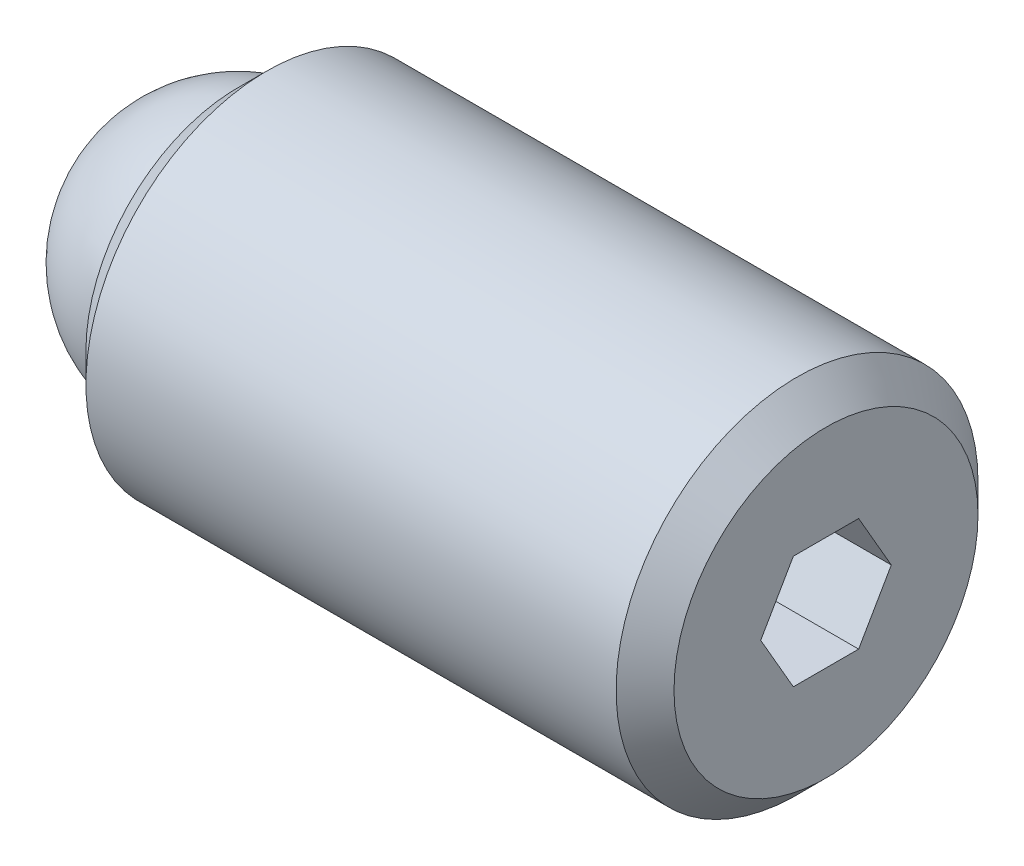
SolidWorks part; units mm, degrees
ref_plane "Front Plane" through (0, 0, 0) normal (0, 0, 1) x (1, 0, 0)
ref_plane "Top Plane" through (0, 0, 0) normal (0, 1, 0) x (1, 0, 0)
ref_plane "Right Plane" through (0, 0, 0) normal (1, 0, 0) x (0, 0, -1)
sketch "Sketch2" plane through (0, 0, 0) normal (1, 0, 0) x (0, 0, -1)
  circle A0 centre (0, 0) radius 3.175
  dimension "D1" = 6.35
extrude "Boss-Extrude1" add sketch "Sketch2" along normal blind 10.3187
sketch "Sketch3" plane through (0, 0, 0) normal (-1, 0, 0) x (0, 0, 1)
  circle A0 centre (0, 0) radius 2.3813
  dimension "D1" = 4.7625
chamfer "Chamfer1" distance 0.508 angle 45 1 edges at (0, 0, -3.175)
chamfer "Chamfer2" distance 0.508 angle 45 1 edges at (10.3187, 0, -3.175)
sketch "Sketch4" plane through (10.3187, 0, 0) normal (1, 0, 0) x (0, 0, -1)
  line L1 (1.1457, 0) -> (0.5728, 0.9922)
  line L2 (0.5728, 0.9922) -> (-0.5728, 0.9922)
  line L3 (-0.5728, 0.9922) -> (-1.1457, 0)
  line L4 (-1.1457, 0) -> (-0.5728, -0.9922)
  line L5 (-0.5728, -0.9922) -> (0.5728, -0.9922)
  line L6 (0.5728, -0.9922) -> (1.1457, 0)
  circle A0 centre (0, 0) radius 0.9922 construction
  dimension "D1" = 1.9844
extrude "Cut-Extrude2" cut sketch "Sketch4" against normal blind 2.286
extrude "Cut-Extrude3" cut sketch "Sketch3" against normal blind 2.3813
sketch "Sketch5" plane through (0, 0, 0) normal (-1, 0, 0) x (0, 0, 1)
  line L0 (0, 0) -> (0, -2.3813)
  line L1 (0, 0) -> (0, 2.3813)
  arc A0 (0, 2.3813) -> (0, -2.3813) centre (0, 0) ccw
  dimension "D1" = 2.3813
revolve "Revolve1" add sketch "Sketch5" angle 360 about L1
sketch "Sketch7" plane through (0, 0, 0) normal (-1, 0, 0) x (0, 0, 1)
  line L0 (0, 0) -> (0, 2.3813) construction
  circle A0 centre (0, 0) radius 2.3813 construction
  arc A1 (0.0635, 2.3804) -> (-0.0635, 2.3804) centre (0, 0) ccw
  arc A2 (0.0635, 2.3804) -> (-0.0635, 2.3804) centre (0, 2.3813) ccw
  dimension "D1" = 0.127
extrude "Cut-Extrude4" cut sketch "Sketch7" against normal up to surface (2.3813 mm away) contours A2 A1
